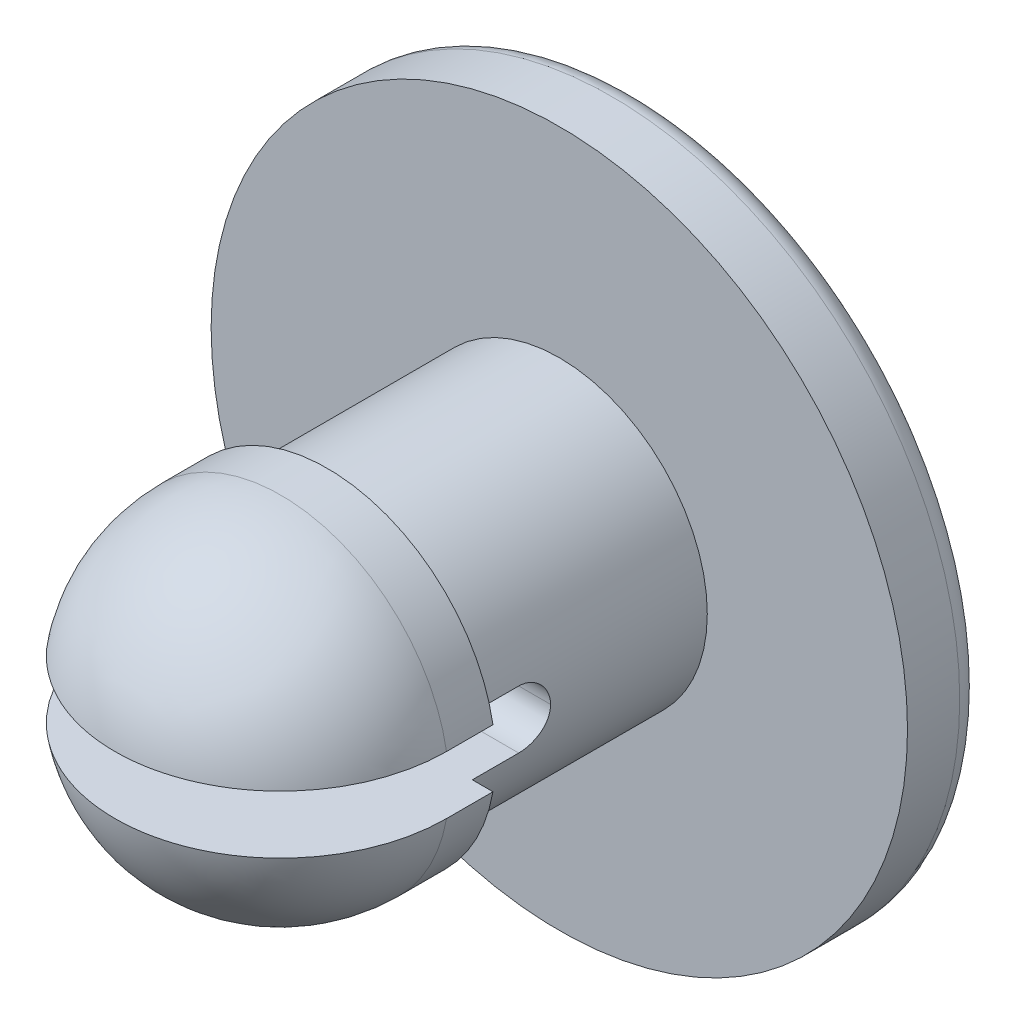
SolidWorks part; units mm, degrees
ref_plane "Face" through (0, 0, 0) normal (0, 0, 1) x (1, 0, 0)
ref_plane "Dessus" through (0, 0, 0) normal (0, 1, 0) x (1, 0, 0)
ref_plane "Droite" through (0, 0, 0) normal (1, 0, 0) x (0, 0, -1)
sketch "Esquisse1" plane through (0, 0, 0) normal (0, 0, 1) x (1, 0, 0)
  circle A0 centre (0, 0) radius 6
  dimension "D1" = 12
extrude "Base-Extrusion" add sketch "Esquisse1" against normal blind 1.3
sketch "Esquisse2" plane through (0, 0, 0) normal (0, 0, 1) x (1, 0, 0)
  circle A0 centre (0, 0) radius 2.55
  dimension "D1" = 5.1
extrude "Boss.-Extru.1" add sketch "Esquisse2" along normal blind 4
sketch "Esquisse3" plane through (0, 0, 4) normal (0, 0, 1) x (1, 0, 0)
  circle A0 centre (0, 0) radius 2.9
  dimension "D1" = 5.8
extrude "Boss.-Extru.2" add sketch "Esquisse3" along normal blind 3.7
fillet "Congé3" radius 2.9
sketch "Esquisse4" plane through (0, 0, 7.7) normal (0, 0, 1) x (1, 0, 0)
  line L1 (-3.7458, 0.5) -> (4.0086, 0.5)
  line L2 (-3.7458, 0.5) -> (-3.7458, -0.5)
  line L3 (-3.7458, -0.5) -> (4.0086, -0.5)
  line L4 (4.0086, 0.5) -> (4.0086, -0.5)
  dimension "D1" = 0.5
  dimension "D2" = 1
ref_plane "Plan1" through (0, 0, 7.7) normal (0, 0, 1) x (1, 0, 0)
sketch "Esquisse5" plane through (0, 0, 7.7) normal (0, 0, 1) x (1, 0, 0)
  line L1 (-3.6374, 0.5) -> (3.8471, 0.5)
  line L2 (-3.6374, 0.5) -> (-3.6374, -0.5)
  line L3 (-3.6374, -0.5) -> (3.8471, -0.5)
  line L4 (3.8471, 0.5) -> (3.8471, -0.5)
  dimension "D1" = 1
  dimension "D2" = 0.5
extrude "Enlèv. mat.-Extru.2" cut sketch "Esquisse5" against normal blind 5
fillet "Congé4" radius 0.4
fillet "Congé5" radius 0.5
sketch "Esquisse6" plane through (0, 0, 0) normal (0, 0, 1) x (1, 0, 0)
  text T0 "www.a4.fr" font "Arial" height 0.01
extrude "Enlèv. mat.-Extru.3" cut sketch "Esquisse6" against normal blind 0.01
